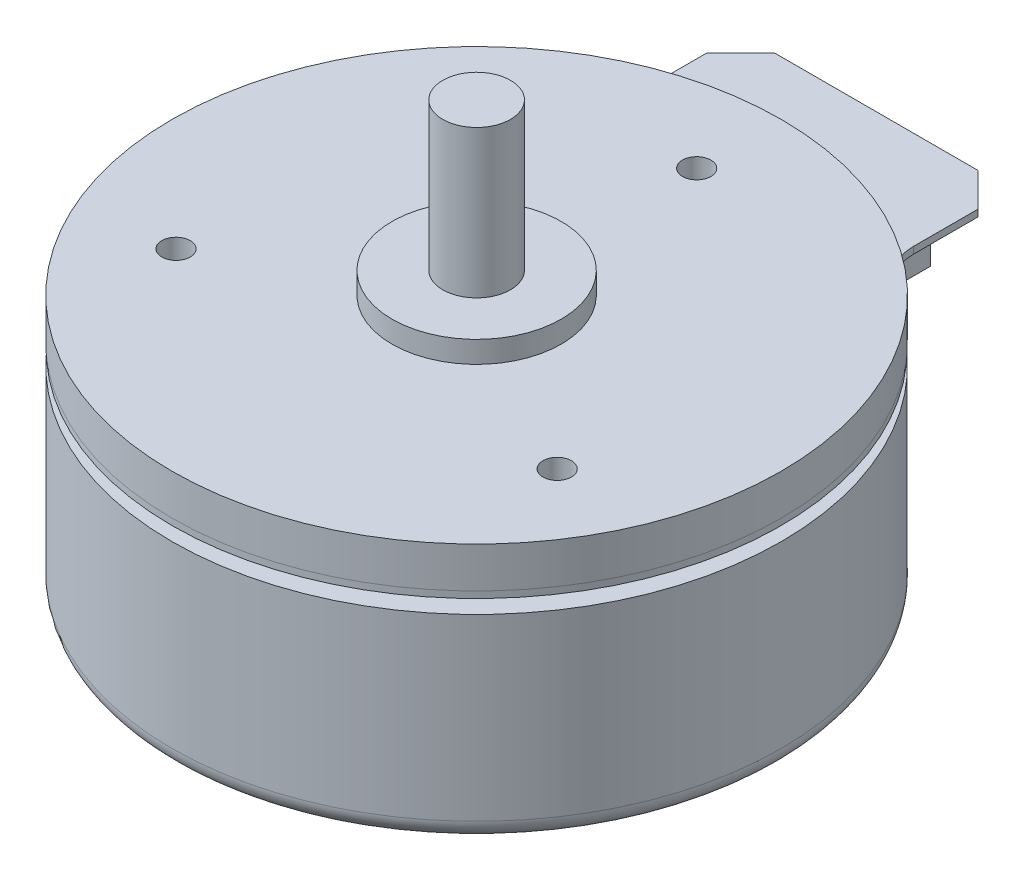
SolidWorks part; units mm, degrees
ref_plane "Front Plane" through (0, 0, 0) normal (0, 0, 1) x (1, 0, 0)
ref_plane "Top Plane" through (0, 0, 0) normal (0, 1, 0) x (1, 0, 0)
ref_plane "Right Plane" through (0, 0, 0) normal (1, 0, 0) x (0, 0, -1)
sketch "Sketch1" plane through (0, 0, 0) normal (0, 1, 0) x (1, 0, 0)
  circle A0 centre (0, 0) radius 45
  dimension "D1" = 90
extrude "Boss-Extrude1" add sketch "Sketch1" along normal blind 6
sketch "Sketch2" plane through (0, 6, 0) normal (0, 1, 0) x (1, 0, 0)
  circle A0 centre (0, 0) radius 12.5
  dimension "D1" = 25
extrude "Boss-Extrude2" add sketch "Sketch2" along normal blind 3.2
sketch "Sketch3" plane through (0, 6, 0) normal (0, 1, 0) x (1, 0, 0)
  circle A0 centre (0, 0) radius 5
  dimension "D1" = 10
extrude "Boss-Extrude3" add sketch "Sketch3" along normal blind 25
sketch "Sketch4" plane through (0, 6, 0) normal (0, 1, 0) x (1, 0, 0)
  line L0 (0, 32.5) -> (0, 0)
  line L1 (0, 0) -> (-28.1458, -16.25)
  line L2 (0, 0) -> (28.1458, -16.25)
  circle A0 centre (0, 0) radius 32.5 construction
  point P0 (0, 32.5)
  point P1 (-28.1458, -16.25)
  point P2 (28.1458, -16.25)
  dimension "D3" = 65
  dimension "D1" = 120
  dimension "D2" = 120
hole_wizard "Tap Drill for M5 Tap1" positions "3DSketch1" profile "Sketch6" hole size "M5" standard "GB"
sketch3d "3DSketch1"
  point P0 (0, 6, -32.5)
  point P3 (28.1458, 6, 16.25)
  point P6 (-28.1458, 6, 16.25)
sketch "Sketch6" plane through (0, 6, -32.5) normal (1, 0, 0) x (0, 0, 1)
  line L0 (0, 0) -> (0, 5.8)
  line L1 (0, 5.8) -> (2.1, 4.5382)
  line L2 (2.1, 4.5382) -> (2.1, 0)
  line L5 (2.1, 0) -> (0, 0)
  line L10 (0, 5.8) -> (-2.1, 4.5382) construction
  line L11 (0, -6.35) -> (0, 107.95) construction
  dimension "Hole Dia." = 4.2
  dimension "Hole Depth" = 5.8
  dimension "Drill Angle" = 118
sketch "Sketch7" plane through (0, 0, 0) normal (0, -1, 0) x (1, 0, 0)
  line L0 (20, -44.5228) -> (20, -54.0503)
  line L1 (20, -54.0503) -> (15.0503, -59)
  line L2 (15.0503, -59) -> (-15.0503, -59)
  line L3 (-15.0503, -59) -> (-20, -54.0503)
  line L4 (-20, -54.0503) -> (-20, -44.5228)
  circle A0 centre (0, 0) radius 44.95 construction
  circle A1 centre (27.25, -44.5228) radius 7.25 construction
  circle A2 centre (-27.25, -44.5228) radius 7.25 construction
  arc A3 (20, -44.5228) -> (23.4653, -38.3391) centre (27.25, -44.5228) cw
  arc A4 (-20, -44.5228) -> (-23.4653, -38.3391) centre (-27.25, -44.5228) ccw
  arc A5 (-23.4653, -38.3391) -> (23.4653, -38.3391) centre (0, 0) cw
  point P14 (0, -59)
  dimension "D2" = 89.9
  dimension "D6" = 14.5
  dimension "D1" = 40
  dimension "D3" = 59
  dimension "D4" = 135
  dimension "D5" = 7
extrude "Boss-Extrude4" add sketch "Sketch7" along normal blind 1
sketch "Sketch8" plane through (0, -1, 0) normal (0, -1, 0) x (1, 0, 0)
  circle A0 centre (0, 0) radius 40
  dimension "D1" = 80
extrude "Boss-Extrude5" add sketch "Sketch8" along normal blind 2
sketch "Sketch9" plane through (0, -3, 0) normal (0, -1, 0) x (1, 0, 0)
  circle A0 centre (0, 0) radius 45
  dimension "D1" = 90
extrude "Boss-Extrude6" add sketch "Sketch9" along normal blind 29.464
fillet "Fillet1" radius 3 1 edges at (0, -32.464, -45)
sketch "Sketch11" plane through (0, 0, 0) normal (0, 1, 0) x (1, 0, 0)
  line L0 (0, 52) -> (0, 59) construction
  line L1 (-10, 47) -> (10, 47)
  line L2 (-10, 47) -> (-10, 57)
  line L3 (-10, 57) -> (10, 57)
  line L4 (10, 47) -> (10, 57)
  line L5 (-10, 47) -> (10, 57) construction
  line L6 (-10, 57) -> (10, 47) construction
  line L7 (-15.0503, 59) -> (15.0503, 59) construction
  line L8 (0, 52) -> (0, 45) construction
  arc A0 (22.8147, 38.7878) -> (-22.8147, 38.7878) centre (0, 0) ccw construction
  point P0 (0, 52)
  dimension "D1" = 10
  dimension "D2" = 20
extrude "Boss-Extrude7" add sketch "Sketch11" against normal blind 13.8 contours L4 L3 L2 L1
sketch "Sketch12" plane through (0, 9.2, 0) normal (0, 1, 0) x (1, 0, 0)
  circle A0 centre (0, 0) radius 12.5
  circle A1 centre (0, 0) radius 11
  dimension "D1" = 25
  dimension "D2" = 22
